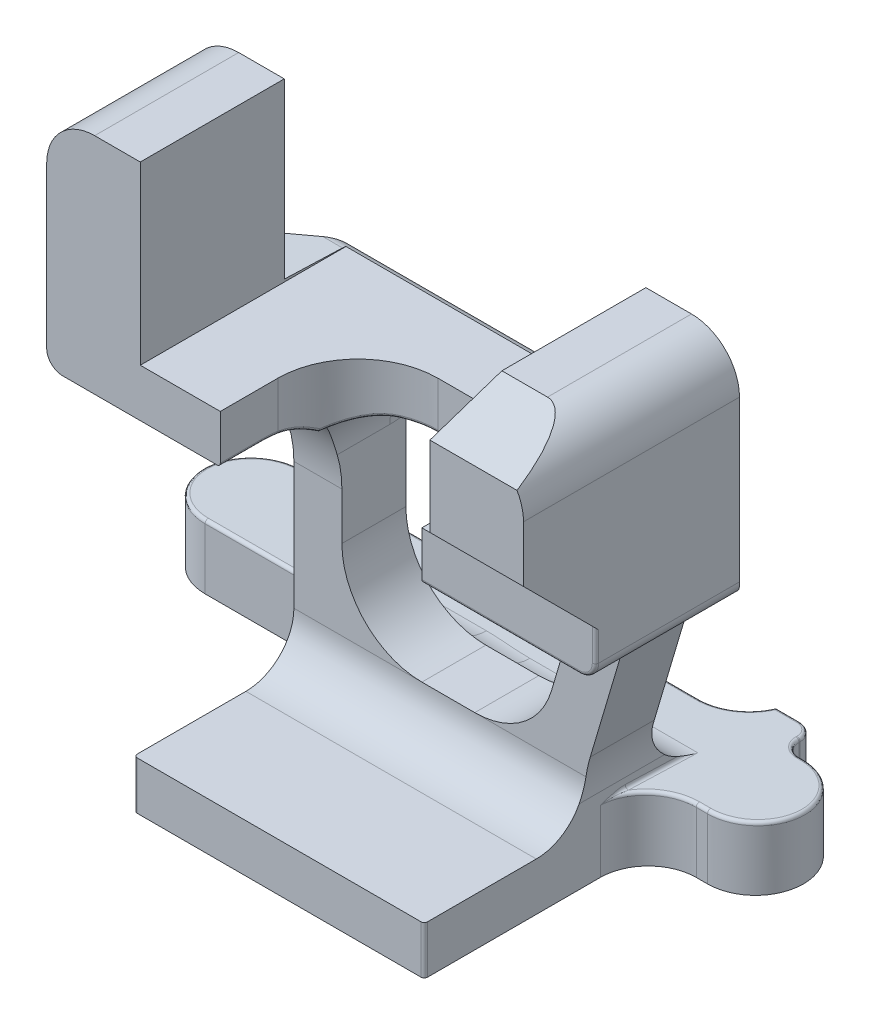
SolidWorks part; units mm, degrees
ref_plane "Front Plane" through (0, 0, 0) normal (0, 0, 1) x (1, 0, 0)
ref_plane "Top Plane" through (0, 0, 0) normal (0, 1, 0) x (1, 0, 0)
ref_plane "Right Plane" through (0, 0, 0) normal (1, 0, 0) x (0, 0, -1)
sketch "Sketch1" plane through (0, 0, 0) normal (0, 1, 0) x (1, 0, 0)
  line L0 (0, 0) -> (32.3271, 0) construction
  line L1 (0, 0) -> (31.4, 0) construction
  line L2 (0, 3) -> (31.4, 3)
  line L3 (0, -3) -> (31.4, -3)
  circle A0 centre (0, 0) radius 0.9271
  circle A1 centre (31.4, 0) radius 0.9271
  arc A2 (0, 3) -> (0, -3) centre (0, 0) ccw
  arc A3 (31.4, -3) -> (31.4, 3) centre (31.4, 0) ccw
  point P5 (15.7, 0)
extrude "Boss-Extrude1" add sketch "Sketch1" along normal blind 3
sketch "Sketch2" plane through (0, 3, 0) normal (0, 1, 0) x (1, 0, 0)
  line L0 (31.4, 3) -> (0, 3) construction
  line L1 (3.7, 3) -> (27.7, 3)
  line L2 (3.7, 3) -> (3.7, -3)
  line L3 (3.7, -3) -> (27.7, -3)
  line L4 (27.7, 3) -> (27.7, -3)
  line L5 (0, -3) -> (31.4, -3) construction
  dimension "D1" = 3.7
  dimension "D2" = 24
extrude "Boss-Extrude2" add sketch "Sketch2" along normal blind 20.95
sketch "Sketch3" plane through (0, 0, 3) normal (0, 0, 1) x (1, 0, 0)
  line L0 (0, 0) -> (31.4, 0) construction
  line L1 (27.7, 23.95) -> (3.7, 23.95)
  line L2 (27.7, 23.95) -> (27.7, 0)
  line L3 (27.7, 0) -> (3.7, 0)
  line L4 (3.7, 23.95) -> (3.7, 0)
  line L5 (0, 3) -> (0, 0) construction
  dimension "D1" = 3.7
  dimension "D2" = 24
  dimension "D3" = 23.95
extrude "Boss-Extrude3" add sketch "Sketch3" along normal blind 22
sketch "Sketch4" plane through (0, 23.95, 0) normal (0, 1, 0) x (1, 0, 0)
  line L0 (3.7, 3) -> (3.7, -25) construction
  line L1 (27.7, -7.6) -> (3.7, -7.6) construction
  line L2 (27.7, -25) -> (27.7, 3) construction
  line L3 (27.7, -7.6) -> (32.15, -7.6) construction
  line L4 (3.7, -7.6) -> (9.55, -7.6)
  line L6 (3.7, -7.6) -> (3.7, -8.6)
  line L7 (3.7, -8.6) -> (9.55, -8.6)
  line L8 (9.55, -7.6) -> (9.55, -8.6)
  line L9 (32.15, -7.6) -> (38, -7.6)
  line L10 (3.7, -25) -> (3.7, 3) construction
  line L11 (32.15, -7.6) -> (32.15, -8.6)
  line L12 (32.15, -8.6) -> (38, -8.6)
  line L13 (38, -7.6) -> (38, -8.6)
  circle A0 centre (0, 0) radius 0.9271 construction
  dimension "D5" = 1
  dimension "D1" = 5.85
  dimension "D2" = 1
  dimension "D3" = 7.6
  dimension "D4" = 5.85
  dimension "D6" = 32.15
extrude "Boss-Extrude4" add sketch "Sketch4" along normal blind 11
sketch "Sketch7" plane through (3.7, 0, 0) normal (-1, 0, 0) x (0, 0, 1)
  line L1 (25, 0) -> (3, 0) construction
  line L2 (25, 0) -> (7, 0)
  line L3 (25, 0) -> (25, 20.95)
  line L4 (25, 20.95) -> (7, 20.95)
  line L5 (7, 0) -> (7, 20.95)
  line L6 (-3, 23.95) -> (3, 23.95)
  line L7 (-3, 23.95) -> (-3, 3)
  line L8 (-3, 3) -> (3, 3)
  line L9 (3, 23.95) -> (3, 3)
  line L10 (25, 23.95) -> (25, 0) construction
  line L11 (3, 3) -> (3, 0) construction
  line L12 (8.6, 23.95) -> (25, 23.95) construction
  dimension "D1" = 3
  dimension "D2" = 4
extrude "Cut-Extrude2" cut sketch "Sketch7" against normal through all
sketch "Sketch9" plane through (0, 23.95, 0) normal (0, 1, 0) x (1, 0, 0)
  line L0 (3.7, -8.6) -> (9.55, -8.6) construction
  line L1 (3.7, -8.6) -> (9.55, -8.6)
  line L2 (3.7, -8.6) -> (3.7, -16.6)
  line L3 (3.7, -16.6) -> (9.55, -16.6)
  line L4 (9.55, -8.6) -> (9.55, -16.6)
  line L5 (32.15, -8.6) -> (38, -8.6)
  line L6 (32.15, -8.6) -> (32.15, -16.6)
  line L7 (32.15, -16.6) -> (38, -16.6)
  line L8 (38, -8.6) -> (38, -16.6)
  line L9 (3.7, -8.6) -> (3.7, -25) construction
  dimension "D1" = 5.85
  dimension "D2" = 8
  dimension "D3" = 8
  dimension "D4" = 5.85
extrude "Boss-Extrude6" add sketch "Sketch9" along normal up to surface (11 mm away)
sketch "Sketch12" plane through (0, 0, 3) normal (0, 0, -1) x (-1, 0, 0)
  line L0 (-38, 23.95) -> (-38, 34.95) construction
  line L1 (-27.7, 23.95) -> (-38, 23.95)
  line L2 (-27.7, 23.95) -> (-27.7, 20.95)
  line L3 (-27.7, 20.95) -> (-38, 20.95)
  line L4 (-38, 23.95) -> (-38, 20.95)
  dimension "D1" = 3
extrude "Boss-Extrude11" add sketch "Sketch12" against normal blind 22
sketch "Sketch14" plane through (0, 0, -3) normal (0, 0, -1) x (-1, 0, 0)
  line L0 (-38, 23.95) -> (-32.15, 23.95) construction
  line L1 (-9.55, 23.95) -> (-3.7, 23.95) construction
  line L2 (-38, 34.95) -> (-38, 23.95) construction
  line L3 (-9.55, 34.95) -> (-9.55, 23.95) construction
  circle A0 centre (-35.1, 29.75) radius 0.9271
  circle A1 centre (-6.65, 29.75) radius 0.9271
extrude "Cut-Extrude4" cut sketch "Sketch14" against normal through all
sketch "Sketch15" plane through (0, 23.95, 0) normal (0, 1, 0) x (1, 0, 0)
  line L0 (3.7, -16.6) -> (9.55, -16.6)
  line L1 (9.55, -16.6) -> (9.55, -21.5)
  line L2 (9.55, -21.5) -> (32.15, -21.5)
  line L3 (32.15, -21.5) -> (32.15, -16.6)
  line L4 (32.15, -16.6) -> (38, -16.6)
  line L5 (38, -16.6) -> (38, -25)
  line L6 (38, -25) -> (3.7, -25)
  line L7 (3.7, -25) -> (3.7, -16.6)
  line L8 (27.7, -3) -> (3.7, -3) construction
  line L9 (3.7, -7.6) -> (9.55, -7.6)
  line L10 (3.7, -7.6) -> (3.7, -3)
  line L11 (3.7, -3) -> (9.55, -3)
  line L12 (9.55, -7.6) -> (9.55, -3)
  line L13 (38, -7.6) -> (32.15, -7.6) construction
  line L14 (32.15, -7.6) -> (38, -7.6)
  line L15 (32.15, -7.6) -> (32.15, -3)
  line L16 (32.15, -3) -> (38, -3)
  line L17 (38, -7.6) -> (38, -3)
  dimension "D1" = 3.5
  dimension "D2" = 5.85
  dimension "D3" = 5.85
extrude "Cut-Extrude5" cut sketch "Sketch15" against normal through all
sketch "Sketch17" plane through (0, 23.95, 0) normal (0, 1, 0) x (1, 0, 0)
  line L0 (9.55, -3) -> (32.15, -3) construction
  line L1 (3.7, -16.6) -> (9.55, -16.6) construction
  line L2 (14.55, -16.6) -> (14.55, -8)
  line L3 (14.55, -8) -> (27.15, -8)
  line L4 (27.15, -16.6) -> (27.15, -8)
  line L5 (14.55, -16.6) -> (27.15, -8) construction
  line L6 (14.55, -8) -> (27.15, -16.6) construction
  line L7 (9.55, -21.5) -> (9.55, -16.6) construction
  line L9 (32.15, -16.6) -> (32.15, -21.5) construction
  line L10 (14.55, -16.6) -> (9.55, -16.6)
  line L11 (32.15, -21.5) -> (9.55, -21.5)
  line L12 (32.15, -21.5) -> (32.15, -16.6)
  line L13 (32.15, -16.6) -> (27.15, -16.6)
  line L14 (9.55, -21.5) -> (9.55, -16.6)
  point P0 (20.85, -12.3)
extrude "Cut-Extrude7" cut sketch "Sketch17" against normal through all
sketch "Sketch20" plane through (0, 0, 0) normal (0, 1, 0) x (1, 0, 0)
  line L0 (27.7, -7) -> (27.7, -3) construction
  line L1 (9.55, -7) -> (27.7, -7)
  line L2 (9.55, -7) -> (9.55, -17)
  line L3 (9.55, -17) -> (27.7, -17)
  line L4 (27.7, -7) -> (27.7, -17)
  line L6 (31.4, 3) -> (0, 3) construction
  line L7 (30.4, 3) -> (27.4, 3)
  line L8 (30.4, 3) -> (30.4, 5)
  line L9 (30.4, 5) -> (27.4, 5)
  line L10 (27.4, 3) -> (27.4, 5)
  line L12 (1, 3) -> (4, 3)
  line L13 (1, 3) -> (1, 5)
  line L14 (1, 5) -> (4, 5)
  line L15 (4, 3) -> (4, 5)
  circle A0 centre (31.4, 0) radius 0.9271 construction
  circle A1 centre (0, 0) radius 0.9271 construction
extrude "Boss-Extrude13" add sketch "Sketch20" along normal blind 3
sketch "Sketch18" plane through (0, 0, 3) normal (0, 0, -1) x (-1, 0, 0)
  line L0 (-27.7, 3) -> (-27.7, 20.95) construction
  line L1 (-32.15, 20.95) -> (-27.7, 20.95)
  line L4 (-27.7, 20.95) -> (-27.7, 5.95)
  line L6 (-32.15, 20.95) -> (-27.7, 20.95) construction
  line L7 (-32.15, 20.95) -> (-27.7, 5.95)
  dimension "D1" = 15
  dimension "D2" = 4.45
extrude "Boss-Extrude12" add sketch "Sketch18" against normal up to surface (4 mm away)
sketch "Sketch22" plane through (0, 23.95, 0) normal (0, 1, 0) x (1, 0, 0)
  line L1 (9.55, -3) -> (3.7, -3)
  line L2 (9.55, -3) -> (9.55, -7.6)
  line L3 (9.55, -7.6) -> (3.7, -7.6)
  line L4 (3.7, -3) -> (3.7, -7.6)
  line L5 (32.15, -3) -> (38, -3)
  line L6 (32.15, -3) -> (32.15, -7.6)
  line L7 (32.15, -7.6) -> (38, -7.6)
  line L8 (38, -3) -> (38, -7.6)
extrude "Boss-Extrude14" add sketch "Sketch22" against normal blind 3
sketch "Sketch28" plane through (0, 3, 0) normal (0, 1, 0) x (1, 0, 0)
  circle A0 centre (0, 0) radius 1.1
  circle A1 centre (31.4, 0) radius 1.1
  dimension "D1" = 2.2
  dimension "D2" = 2.2
extrude "Boss-Extrude16" add sketch "Sketch28" against normal blind 1
sketch "Sketch29" plane through (0, 0, 16.6) normal (0, 0, 1) x (1, 0, 0)
  circle A0 centre (6.65, 29.75) radius 1
  circle A1 centre (35.1, 29.75) radius 1
  dimension "D1" = 2
  dimension "D2" = 2
extrude "Boss-Extrude17" add sketch "Sketch29" against normal blind 1
sketch "Sketch16" plane through (0, 0, 3) normal (0, 0, -1) x (-1, 0, 0)
  line L1 (-24.5856, 6) -> (-12.55, 6)
  line L3 (-24.6717, 20.95) -> (-12.55, 20.95)
  line L4 (-12.55, 6) -> (-12.55, 20.95)
  line L5 (-24.5856, 6) -> (-12.55, 20.95) construction
  line L6 (-24.6717, 20.95) -> (-12.55, 6) construction
  line L7 (-9.55, 3) -> (-9.55, 20.95) construction
  line L8 (-27.7, 3) -> (-9.55, 3) construction
  line L9 (-3.7, 23.95) -> (-38, 23.95) construction
  line L10 (-24.6717, 20.95) -> (-29.0208, 20.95)
  line L11 (-29.0208, 20.95) -> (-24.5856, 6)
  line L13 (-32.15, 20.95) -> (-27.7, 5.95) construction
  point P0 (-18.5893, 13.4483)
  dimension "D1" = 3
  dimension "D2" = 3
  dimension "D3" = 3
  dimension "D4" = 3
extrude "Cut-Extrude6" cut sketch "Sketch16" against normal through all
sketch "Sketch25" plane through (0, 23.95, 0) normal (0, 1, 0) x (1, 0, 0)
  line L0 (0, -3) -> (9.55, -3) construction
  line L1 (38, -7.6) -> (3.7, -7.6)
  line L4 (38, -7.6) -> (38, -3)
  line L6 (38, -3) -> (3.7, -3)
  line L7 (3.7, -7.6) -> (3.7, -3)
  line L8 (3.7, -3) -> (3.7, -7.6) construction
extrude "Cut-Extrude8" cut sketch "Sketch25" against normal blind 0.001
sketch "Sketch30" plane through (38, 0, 0) normal (1, 0, 0) x (0, 0, -1)
  line L1 (-16.6, 34.95) -> (-21.1, 33.45)
  line L2 (-16.6, 34.95) -> (-16.6, 23.95)
  line L3 (-16.6, 23.95) -> (-21.1, 28.45)
  line L4 (-21.1, 33.45) -> (-21.1, 28.45)
  line L10 (-16.6, 34.95) -> (-7.6, 34.95) construction
  point P10 (-21.1, 30.95)
  dimension "D1" = 4.5
  dimension "D2" = 5
  dimension "D3" = 45
  dimension "D4" = 1.5
extrude "Boss-Extrude18" add sketch "Sketch30" against normal up to surface (5.85 mm away)
sketch "Sketch31" plane through (0, 3, 0) normal (0, 1, 0) x (1, 0, 0)
  line L12 (31.4, 3) -> (30.4, 3)
  line L13 (30.4, 3) -> (30.4, 5)
  line L14 (30.4, 5) -> (27.4, 5)
  line L15 (27.4, 5) -> (27.4, 3)
  line L16 (27.4, 3) -> (4, 3)
  line L17 (4, 3) -> (4, 5)
  line L18 (4, 5) -> (1, 5)
  line L19 (1, 5) -> (1, 3)
  line L20 (1, 3) -> (0, 3)
  line L21 (0, -3) -> (9.55, -3)
  line L22 (9.55, -3) -> (27.7, -3)
  line L23 (27.7, -3) -> (31.4, -3)
  line L24 (31.4, 3) -> (30.4, 3)
  line L25 (30.4, 3) -> (30.4, 5)
  line L26 (30.4, 5) -> (27.4, 5)
  line L27 (27.4, 5) -> (27.4, 3)
  line L28 (27.4, 3) -> (4, 3)
  line L29 (4, 3) -> (4, 5)
  line L30 (4, 5) -> (1, 5)
  line L31 (1, 5) -> (1, 3)
  line L32 (1, 3) -> (0, 3)
  line L33 (0, -3) -> (9.55, -3)
  line L34 (9.55, -3) -> (27.7, -3)
  line L35 (27.7, -3) -> (31.4, -3)
  arc A2 (0, 3) -> (0, -3) centre (0, 0) ccw
  arc A3 (31.4, -3) -> (31.4, 3) centre (31.4, 0) ccw
  arc A4 (0, 3) -> (0, -3) centre (0, 0) ccw
  arc A5 (31.4, -3) -> (31.4, 3) centre (31.4, 0) ccw
  dimension "D1" = 0
extrude "Boss-Extrude19" add sketch "Sketch31" along normal blind 1
sketch "Sketch32" plane through (0, 23.949, 0) normal (0, 1, 0) x (1, 0, 0)
  line L3 (38, -7.6) -> (38, -3)
  line L4 (38, -3) -> (32.15, -3)
  line L6 (9.55, -3) -> (3.7, -3)
  line L7 (3.7, -3) -> (3.7, -7.6)
  line L10 (38, -7.6) -> (32.15, -3)
  line L11 (9.55, -3) -> (3.7, -7.6)
  dimension "D1" = 4.6
  dimension "D2" = 5.85
  dimension "D3" = 4.6
  dimension "D4" = 5.85
extrude "Cut-Extrude9" cut sketch "Sketch32" against normal blind 3
draft "Draft2" type of draft neutral plane draft angle 2 faces to draft 6 parameters "D1"=2
fillet "Fillet14" radius 9 1 edges at (27.7, 5.95, 5)
fillet "Fillet16" radius 1 4 edges at (38, 20.95, 12.1) (3.7, 20.95, 12.1) (20.7854, 20.95, 3) (20.85, 23.949, 3)
fillet "Fillet18" radius 3 1 edges at (32.15, 20.95, 5)
fillet "Fillet19" radius 5 8 edges at (14.55, 22.45, 8) (27.15, 22.45, 8) (12.55, 6, 5) (12.55, 20.95, 5.5) (24.5856, 6, 5) (29.0208, 20.95, 5.5) (29.1077, 21.2429, 3.2929) (12.55, 21.2429, 3.2929)
fillet "Fillet20" radius 7 1 edges at (13.55, 20.95, 7)
fillet "Fillet21" radius 5 1 edges at (28.3556, 20.95, 7)
fillet "Fillet22" radius 3 2 edges at (18.625, 3, 7) (18.625, 4, 3)
fillet "Fillet23" radius 3 2 edges at (3.7, 34.95, 12.1) (38, 34.95, 12.1)
fillet "Fillet24" radius 3 4 edges at (27.6095, 1.8952, -3) (3.7905, 1.8952, -3) (27.7, 2, 3) (9.55, 2, 3)
fillet "Fillet25" radius 1 4 edges at (30.1905, 1.8952, -3) (30.1206, 1.8603, -5) (1.2095, 1.8952, -3) (1.2794, 1.8603, -5)
fillet "Fillet30" radius 0.2 35 edges at (14.55, 20.95, 15.3) (9.55, 1.5, 17) (27.7, 1.5, 17) (38, 22.95, 16.6) (34.4, 3.8952, 0) (31.2781, 3.7905, -3) (2.9828, 3.7206, -5) (-3, 3.8952, 0) (3.275, 4, 3) (37.7071, 21.2429, 16.6) (20.85, 20.95, 8) (18.5285, 20.95, 8.1055) (14.55, 20.932, 13.4987) (12.7902, 17.4811, 7.9559) (15.9289, 20.6799, 9.5521) (22.236, 20.95, 8.0007) (25.8136, 20.3349, 9.5973) (23.6367, 20.7741, 8.2261) (9.55, 4.0018, 3.0523) (27.7, 4.0018, 3.0523) (15.7, 3.7905, -3) (31.05, 4, 3) (26.583, 3.7713, -3.5505) (4.817, 3.7713, -3.5505) (28.5787, 4.0307, 3.8787) (8.6713, 4.0307, 3.8787) (30.1556, 3.7556, -4) (28.4172, 3.7206, -5) (1.2444, 3.7556, -4) (0.1219, 3.7905, -3) (1.5504, 3.7304, -4.7193) (29.8496, 3.7304, -4.7193) (30.4615, 3.7807, -3.2807) (0.9385, 3.7807, -3.2807)
sketch "Sketch33" plane through (0, 0, 0) normal (0, -1, 0) x (1, 0, 0)
  circle A0 centre (31.4, 0) radius 0.9271
  circle A1 centre (0, 0) radius 0.9271
  circle A2 centre (0, 0) radius 0.9271 construction
extrude "Cut-Extrude10" cut sketch "Sketch33" against normal blind 3
equation "\"D1@Sketch1\"=\"D2@Sketch1\""
equation "\"D4@Sketch14\"= \"D3@Sketch14\""
equation "\"D2@Sketch14\"=\"D1@Sketch14\""
equation "\"D6@Sketch14\"=\"D5@Sketch14\""
equation "\"D2@Sketch17\"=\"D1@Sketch17\""
equation "\"D4@Sketch17\"=\"D2@Sketch17\""
equation "\"D5@Sketch20\"=\"D4@Sketch20\""
